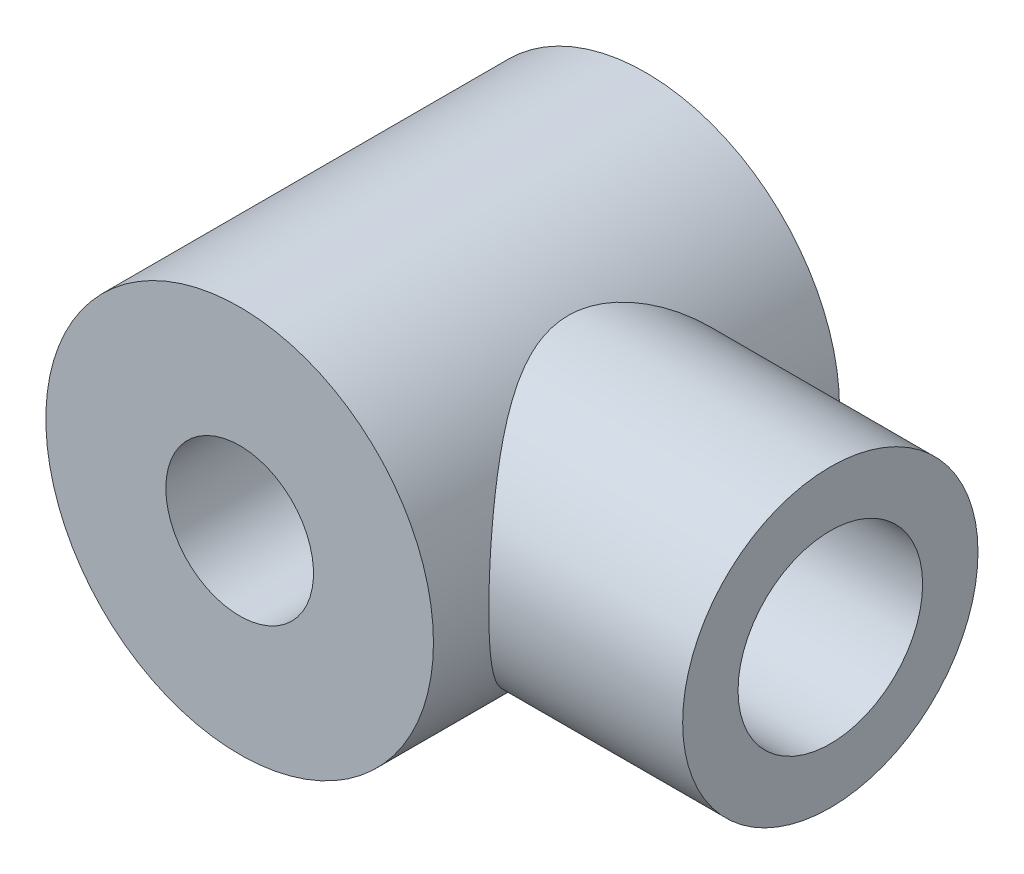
SolidWorks part; units mm, degrees
ref_plane "Plan1" through (0, 0, 0) normal (0, 0, 1) x (1, 0, 0)
ref_plane "Plan2" through (0, 0, 0) normal (0, 1, 0) x (1, 0, 0)
ref_plane "Plan3" through (0, 0, 0) normal (1, 0, 0) x (0, 0, -1)
sketch "Esquisse1" plane through (0, 0, 0) normal (0, 0, 1) x (1, 0, 0)
  circle A0 centre (0, 0) radius 10.5
  dimension "D1" = 21
extrude "Base-Extrusion" add sketch "Esquisse1" along normal blind 22
sketch "Esquisse2" plane through (0, 0, 0) normal (1, 0, 0) x (0, 0, -1)
  line L0 (-22, 0) -> (0, 0) construction
  circle A0 centre (-11, 0) radius 8
  dimension "D1" = 16
extrude "Boss.-Extru.1" add sketch "Esquisse2" along normal blind 21
sketch "Esquisse3" plane through (21, 0, 0) normal (1, 0, 0) x (0, 0, -1)
  line L0 (-22, 0) -> (0, 0) construction
  circle A0 centre (-11, 0) radius 5
  dimension "D1" = 10
other "Perçage1"
sketch "Esquisse4" plane through (0, 0, 0) normal (0, 0, -1) x (-1, 0, 0)
  circle A0 centre (0, 0) radius 4
  circle A1 centre (0, 0) radius 10.5 construction
  dimension "D1" = 8
extrude "Enlèv. mat.-Extru.1" cut sketch "Esquisse3" against normal blind 10
ref_plane "Plan4" through (0, 0, 11) normal (0, 0, 1) x (1, 0, 0)
sketch "Esquisse5" plane through (0, 0, 11) normal (0, 0, 1) x (1, 0, 0)
  circle A0 centre (0, 0) radius 4 construction
  point P0 (0, 0)
sketch "Esquisse6" plane through (0, 0, 11) normal (0, 0, 1) x (1, 0, 0)
  line L0 (0, 0) -> (-39.0771, 0)
  line L1 (0, 0) -> (0, -35.6806)
